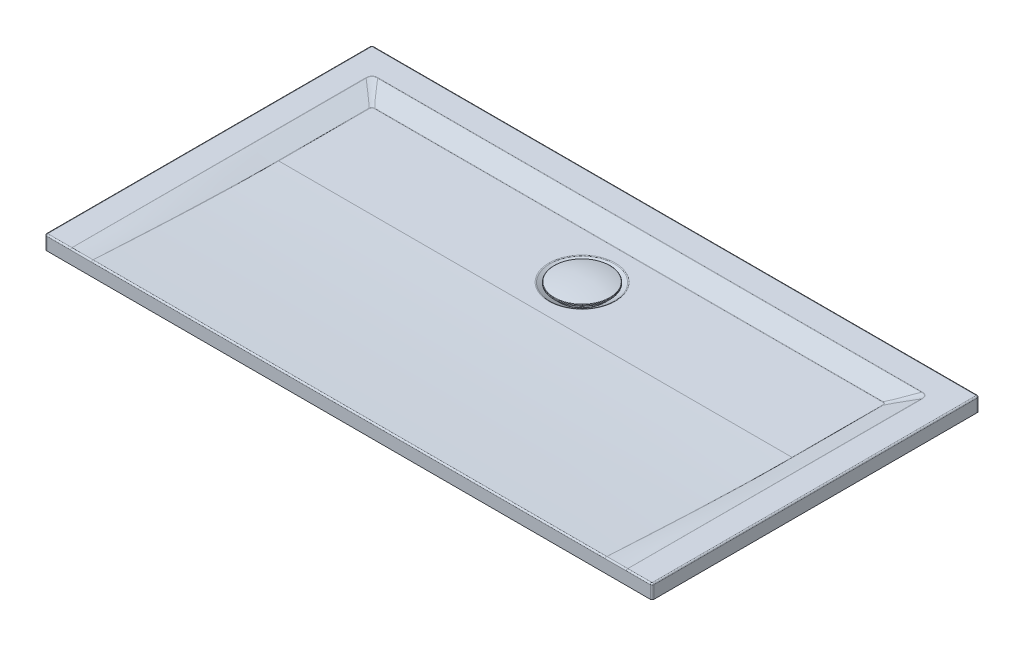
SolidWorks part; units mm, degrees
ref_plane "Płaszczyzna przednia" through (0, 0, 0) normal (0, 0, 1) x (1, 0, 0)
ref_plane "Płaszczyzna górna" through (0, 0, 0) normal (0, 1, 0) x (1, 0, 0)
ref_plane "Płaszczyzna prawa" through (0, 0, 0) normal (1, 0, 0) x (0, 0, -1)
sketch "Szkic1" plane through (0, 0, 0) normal (0, 1, 0) x (1, 0, 0)
  line L0 (0, 350) -> (0, -350) construction
  line L1 (-650, 350) -> (650, 350)
  line L2 (-650, 350) -> (-650, -350)
  line L3 (-650, -350) -> (650, -350)
  line L4 (650, 350) -> (650, -350)
  line L5 (-595, -350) -> (-595, 295)
  line L6 (-595, 295) -> (595, 295)
  line L7 (595, 295) -> (595, -350)
  line L8 (-550, -350) -> (-550, 250)
  line L9 (-550, 250) -> (550, 250)
  line L10 (550, 250) -> (550, -350)
  circle A0 centre (0, 150) radius 45
  circle A1 centre (0, 150) radius 70
  point P9 (0, 295)
  dimension "D6" = 90
  dimension "D7" = 140
  dimension "D1" = 1300
  dimension "D2" = 55
  dimension "D3" = 55
  dimension "D5" = 200
  dimension "D8" = 700
  dimension "D4" = 45
sketch "Szkic2" plane through (0, 0, 0) normal (0, 1, 0) x (1, 0, 0)
  line L0 (-650, -350) -> (650, -350) construction
  line L1 (650, 350) -> (650, -350) construction
  line L2 (595, 295) -> (595, -350) construction
  line L3 (-595, 295) -> (595, 295) construction
  line L4 (-650, 350) -> (650, 350) construction
  line L5 (-595, -350) -> (-595, 295) construction
  line L6 (-650, 350) -> (-650, -350) construction
  line L7 (-650, -350) -> (-595, -350)
  line L8 (650, 350) -> (650, -350)
  line L9 (595, 295) -> (595, -350)
  line L10 (-595, 295) -> (595, 295)
  line L11 (-650, 350) -> (650, 350)
  line L12 (-595, -350) -> (-595, 295)
  line L13 (-650, 350) -> (-650, -350)
  line L14 (595, -350) -> (650, -350)
surface "Powierzchnia-Płaszczyzna1" sketch "Szkic2"
ref_plane "Płaszczyzna1" through (0, -15, 0) normal (0, 1, 0) x (-1, 0, 0)
sketch "Szkic3" plane through (0, -15, 0) normal (0, 1, 0) x (-1, 0, 0)
  line L0 (550, -50) -> (-550, -50)
  line L1 (550, 350) -> (550, -250) construction
  line L2 (-550, -250) -> (-550, 350) construction
  line L3 (0, -50) -> (0, -250) construction
  line L4 (550, -250) -> (-550, -250) construction
  line L5 (-550, -250) -> (-550, -50)
  line L6 (550, -50) -> (550, -250)
  line L7 (550, -250) -> (-550, -250)
  circle A0 centre (0, -150) radius 70 construction
  circle A1 centre (0, -150) radius 70
  point P10 (0, -150)
surface "Powierzchnia-Płaszczyzna2" sketch "Szkic3"
sketch "Szkic4" plane through (0, 0, 0) normal (0, 1, 0) x (1, 0, 0)
  line L0 (550, -350) -> (-550, -350)
other "Granica-Powierzchnia1"
other "Granica-Powierzchnia2"
other "Granica-Powierzchnia3"
mirror "Lustro1" about plane through (0, 0, 0) normal (1, 0, 0)
sketch "Szkic5" plane through (0, 0, 0) normal (0, 1, 0) x (1, 0, 0)
  line L0 (650, 350) -> (650, -350) construction
  line L1 (-650, 350) -> (650, 350) construction
  line L2 (-650, 350) -> (-650, -350) construction
  line L3 (-650, -350) -> (650, -350) construction
  line L4 (650, 350) -> (650, -350)
  line L5 (-650, 350) -> (650, 350)
  line L6 (-650, 350) -> (-650, -350)
  line L7 (-650, -350) -> (650, -350)
surface "Powierzchnia-Wyciągnięcie1" sketch "Szkic5" parameters "D1"=30
sketch "Szkic7" plane through (0, 0, 0) normal (1, 0, 0) x (0, 0, -1)
  line L0 (150, 0) -> (150, -30) construction
  line L1 (350, -30) -> (-350, -30) construction
  line L2 (195, -30) -> (195, -28)
  line L3 (195, -28) -> (199, -28)
  line L6 (199, -28) -> (220, -15)
  dimension "D1" = 90
  dimension "D2" = 2
  dimension "D3" = 98
surface "Powierzchnia-Obrót wokół linii środkowej1" sketch "Szkic7" parameters "D1"=360
surface "Powierzchnia-Płaszczyzna3"
surface "Powierzchnia-Połącz1"
fillet "Zaokrąglenie1" radius 4 6 edges at (0, -28, -199) (0, -15, -80) (650, -15, 350) (650, -15, -350) (-650, -15, -350) (-650, -15, 350)
fillet "Zmienne zaokrąglenie1" radius 40 2 edges at (572.5, -7.5, -272.5)
fillet "Zaokrąglenie3" radius 3 12 edges
fillet "Zaokrąglenie4" radius 3 12 edges at (-648.8284, 0, -348.8284) (0, 0, -350) (648.8284, 0, -348.8284) (650, 0, 0) (648.8284, 0, 348.8284) (620.5, 0, 350) (-620.5, 0, 350) (-648.8284, 0, 348.8284) (-650, 0, 0)
sketch "Szkic8" plane through (0, 0, 0) normal (1, 0, 0) x (0, 0, -1)
  line L0 (150, 0) -> (150, -30) construction
  line L1 (150, -5.6601) -> (179.8469, -5.6601) construction
  line L2 (210, -14.7573) -> (210, -17)
  line L3 (210, -17) -> (150, -17)
  line L4 (150, -17) -> (150, -5.6601)
  line L5 (150, -5.6601) -> (199.9922, 95.6514)
  arc A0 (150, -5.6601) -> (209.2694, -13.7943) centre (150, -225.6601) cw
  arc A1 (209.2694, -13.7943) -> (210, -14.7573) centre (209, -14.7573) cw
  point P11 (210, -14)
  dimension "D1" = 220
  dimension "D4" = 1
  dimension "D2" = 60
  dimension "D3" = 3
  dimension "D5" = 13
revolve "Obrót wokół linii środkowej1" add sketch "Szkic8" angle 360 about L4
